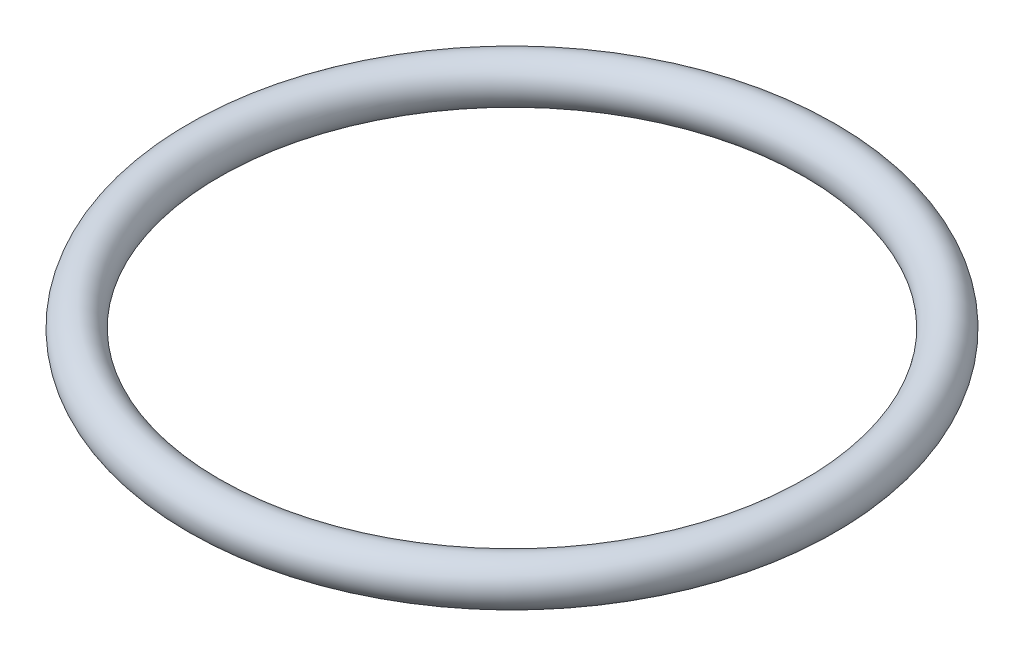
SolidWorks part; units mm, degrees
ref_plane "Face" through (0, 0, 0) normal (0, 0, 1) x (1, 0, 0)
ref_plane "Dessus" through (0, 0, 0) normal (0, 1, 0) x (1, 0, 0)
ref_plane "Droite" through (0, 0, 0) normal (1, 0, 0) x (0, 0, -1)
sketch "Esquisse1" plane through (0, 0, 0) normal (0, 0, 1) x (1, 0, 0)
  line L0 (0, 205.1) -> (0, 217.4558) construction
  arc A1 (18.605, 205.1) -> (18.605, 207.72) centre (18.605, 206.41) ccw
  arc A3 (18.605, 207.72) -> (18.605, 205.1) centre (18.605, 206.41) ccw
  dimension "D1" = 34.59
  dimension "D2" = 2.62
revolve "Révolution1" add sketch "Esquisse1" angle 360 about L0
